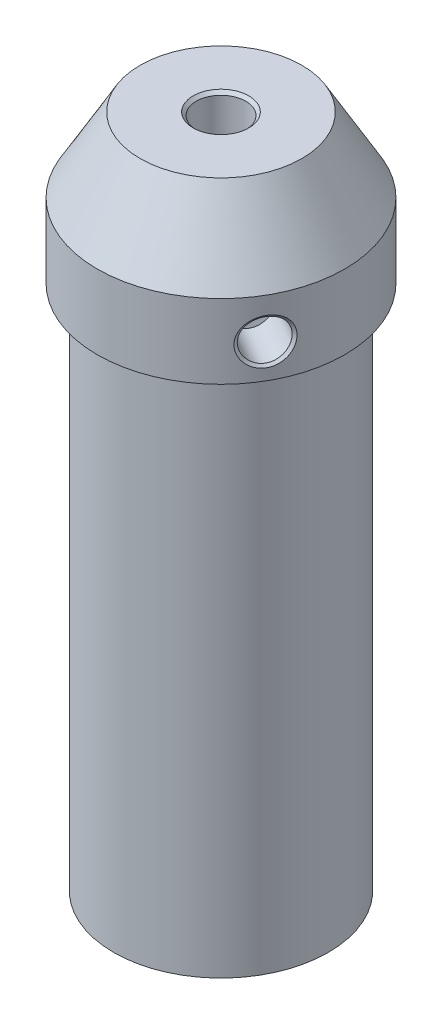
SolidWorks part; units mm, degrees
ref_plane "Plan de face" through (0, 0, 0) normal (0, 0, 1) x (1, 0, 0)
ref_plane "Plan de dessus" through (0, 0, 0) normal (0, 1, 0) x (1, 0, 0)
ref_plane "Plan de droite" through (0, 0, 0) normal (1, 0, 0) x (0, 0, -1)
sketch "Esquisse1" plane through (0, 0, 0) normal (0, 0, 1) x (1, 0, 0)
  line L0 (0, 109) -> (0, 0)
  line L1 (0, 0) -> (-17.35, 0)
  line L2 (-17.35, 0) -> (-17.35, 85)
  line L3 (-17.35, 85) -> (-20, 85)
  line L4 (-20, 85) -> (-20, 109)
  line L5 (-20, 109) -> (0, 109)
  line L6 (0, 143.9092) -> (0, -62.6803) construction
  dimension "D1" = 34.7
  dimension "D2" = 109
  dimension "D3" = 24
  dimension "D4" = 40
revolve "Révolution1" add sketch "Esquisse1" angle 360 about L6
chamfer "Chanfrein1" distance 12 angle 30 1 edges at (0, 109, 20)
sketch "Esquisse2" plane through (0, 0, 0) normal (0, 1, 0) x (1, 0, 0)
  circle A0 centre (0, 0) radius 12.5
  dimension "D1" = 25
extrude "Enlèv. mat.-Extru.1" cut sketch "Esquisse2" along normal blind 98
sketch "Esquisse4" plane through (0, 0, 0) normal (0, 0, 1) x (1, 0, 0)
  line L1 (-17.35, 85) -> (17.35, 85) construction
  circle A0 centre (0, 90.5) radius 3.25
  dimension "D2" = 6.5
  dimension "D1" = 5.5
extrude "Enlèv. mat.-Extru.3" cut sketch "Esquisse4" against normal blind 91
chamfer "Chanfrein2" distance 0.5 angle 45 1 edges at (-3.1738, 91.1997, -19.7466)
pattern_circular "Répétition circulaire1" count 3 every 120 about axis through (0, 143.9092, 0) along (0, -1, 0) of "Enlèv. mat.-Extru.3", "Chanfrein2"
sketch "Esquisse5" plane through (0, 109, 0) normal (0, 1, 0) x (1, 0, 0)
  circle A0 centre (0, 0) radius 4
  dimension "D1" = 8
extrude "Enlèv. mat.-Extru.4" cut sketch "Esquisse5" against normal through all
chamfer "Chanfrein3" distance 0.5 angle 45 1 edges at (0, 109, 4)
